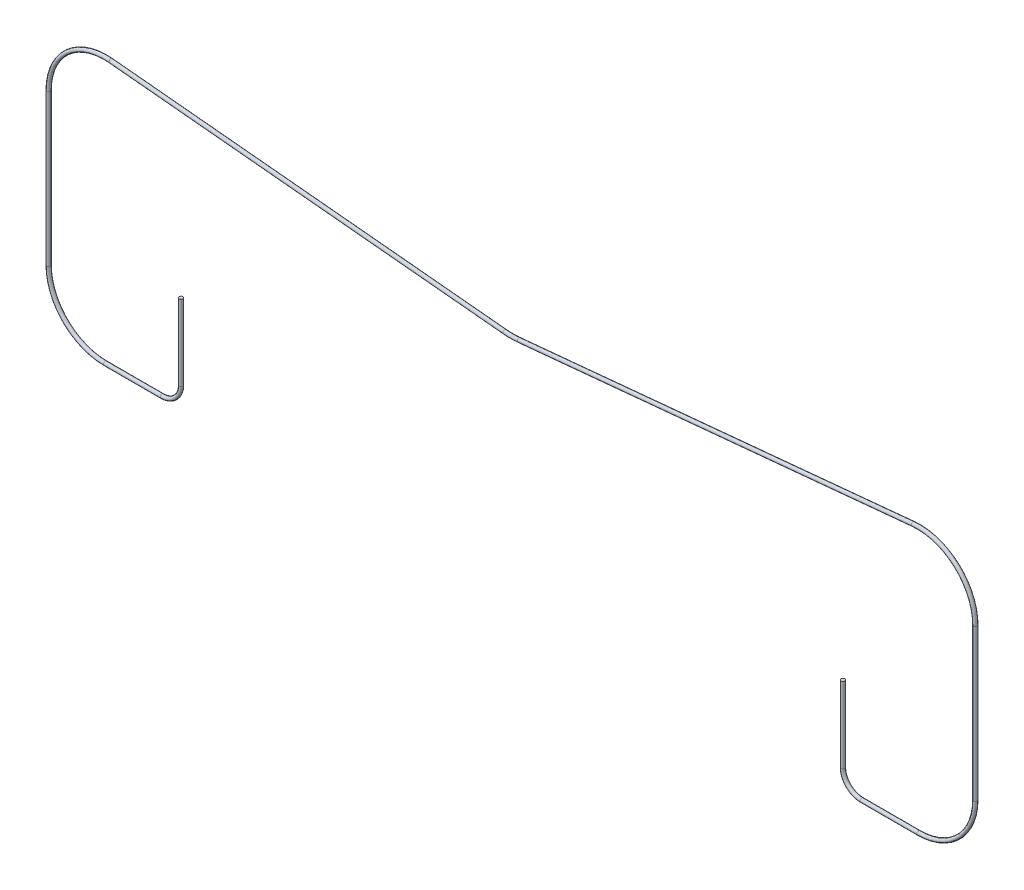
SolidWorks part; units mm, degrees
ref_plane "Face" through (0, 0, 0) normal (0, 0, 1) x (1, 0, 0)
ref_plane "Dessus" through (0, 0, 0) normal (0, 1, 0) x (1, 0, 0)
ref_plane "Droite" through (0, 0, 0) normal (1, 0, 0) x (0, 0, -1)
sketch "Esquisse1" plane through (0, 0, 0) normal (0, 0, 1) x (1, 0, 0)
  line L0 (0, -4) -> (0, 4.0137)
  line L1 (24.5, 2) -> (24.5, 29.1249) construction
  line L2 (49, 4.0137) -> (49, -4)
  line L3 (46, -7) -> (43, -7)
  line L4 (7, -6) -> (7, 1)
  line L5 (8, 2) -> (41, 2)
  line L6 (42, 1) -> (42, -6)
  line L7 (6, -7) -> (3, -7)
  line L8 (3.2858, 7.0001) -> (24.1189, 5.0062)
  line L9 (24.8811, 5.0062) -> (45.7142, 7.0001)
  arc A0 (0, -4) -> (3, -7) centre (3, -4) ccw
  arc A1 (3.2858, 7.0001) -> (0, 4.0137) centre (3, 4.0137) ccw
  arc A2 (49, 4.0137) -> (45.7142, 7.0001) centre (46, 4.0137) ccw
  arc A3 (46, -7) -> (49, -4) centre (46, -4) ccw
  arc A4 (7, -6) -> (6, -7) centre (6, -6) cw
  arc A5 (8, 2) -> (7, 1) centre (8, 1) ccw
  arc A6 (42, 1) -> (41, 2) centre (41, 1) ccw
  arc A7 (43, -7) -> (42, -6) centre (43, -6) cw
  arc A8 (24.1189, 5.0062) -> (24.8811, 5.0062) centre (24.5, 8.988) ccw
  point P19 (7, -7)
  point P31 (24.5, 4.9698)
  dimension "D1" = 3
  dimension "D5" = 1
  dimension "D4" = 4
  dimension "D2" = 49
  dimension "D3" = 7
  dimension "D6" = 7
  dimension "D7" = 7
sketch "Esquisse2" plane through (0, 0, 0) normal (0, 1, 0) x (1, 0, 0)
  circle A0 centre (0, 0) radius 0.1
  dimension "D1" = 0.2
sweep "Balayage1" add profiles "Esquisse2" path "Esquisse1"
sketch "Esquisse3" plane through (0, 0, 0) normal (0, 0, 1) x (1, 0, 0)
  line L1 (5.1992, 3.0465) -> (43.3102, 3.0465)
  line L2 (5.1992, 3.0465) -> (5.1992, -2)
  line L3 (5.1992, -2) -> (43.3102, -2)
  line L4 (43.3102, 3.0465) -> (43.3102, -2)
  dimension "D1" = 2
extrude "Enlèv. mat.-Extru.1" cut sketch "Esquisse3" against normal mid plane 10
